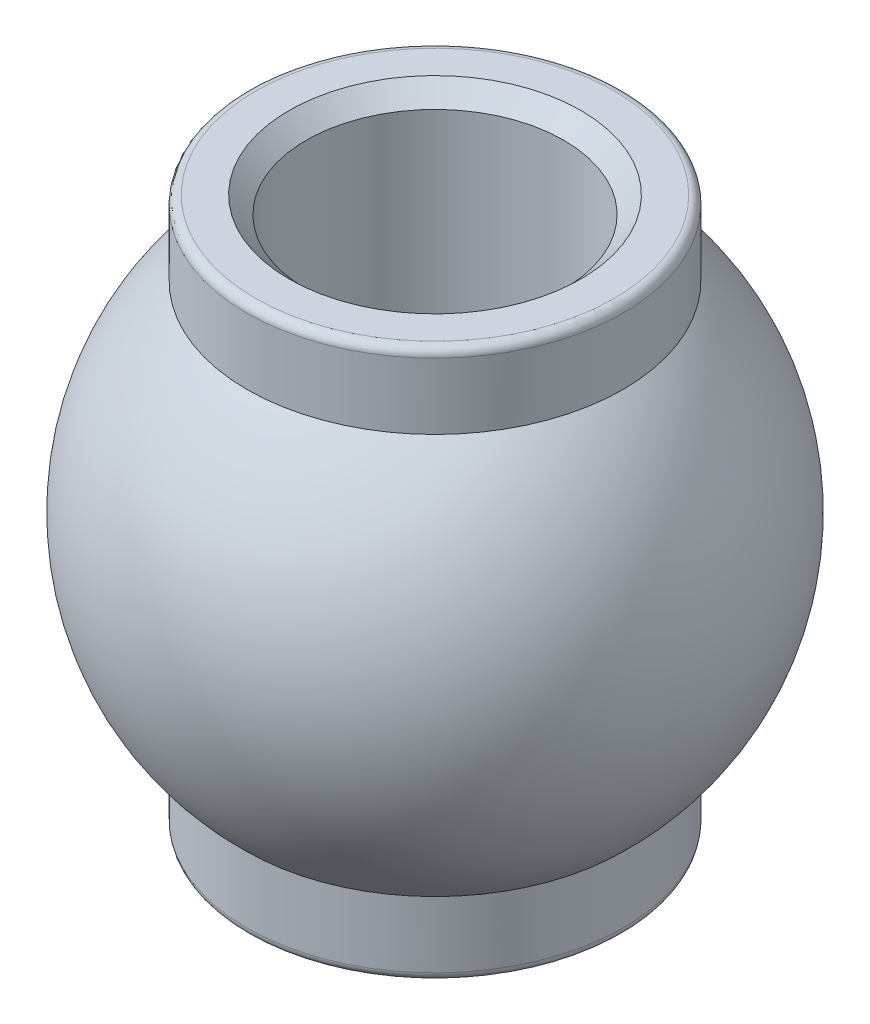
SolidWorks part; units mm, degrees
ref_plane "Plan1" through (0, 0, 0) normal (0, 0, 1) x (1, 0, 0)
ref_plane "Plan2" through (0, 0, 0) normal (0, 1, 0) x (1, 0, 0)
ref_plane "Plan3" through (0, 0, 0) normal (1, 0, 0) x (0, 0, -1)
sketch "Esquisse1" plane through (0, 0, 0) normal (0, 0, 1) x (1, 0, 0)
  line L0 (0, 27) -> (0, -34) construction
  line L1 (24, 0) -> (-27, 0) construction
  line L2 (7.5, 16) -> (7.5, -16)
  line L3 (7.5, 16) -> (10.45, 16)
  line L4 (7.5, -16) -> (10.45, -16)
  line L6 (10.95, 15.5) -> (10.95, 11.6524)
  line L7 (10.95, -11.6524) -> (10.95, -15.5)
  arc A0 (10.45, 16) -> (10.95, 15.5) centre (10.45, 15.5) cw
  arc A1 (10.95, -11.6524) -> (10.95, 11.6524) centre (0, 0) ccw
  arc A2 (10.95, -15.5) -> (10.45, -16) centre (10.45, -15.5) cw
  point P11 (10.95, 16)
  point P17 (10.95, -16)
  dimension "D1" = 15.99
  dimension "D5" = 0.5
  dimension "D2" = 7.5
  dimension "D3" = 3.45
  dimension "D4" = 32
revolve "Base-Révolution" add sketch "Esquisse1" angle 360 about L0
chamfer "Chanfrein1" distance 1 angle 45
